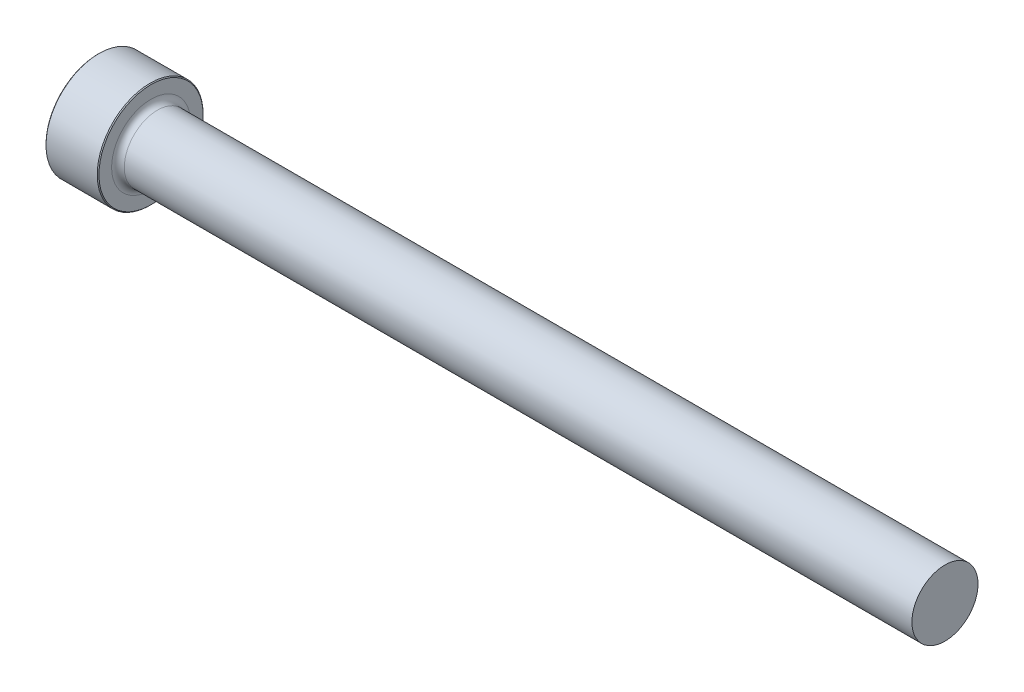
SolidWorks part; units mm, degrees
ref_plane "Front Plane" through (0, 0, 0) normal (0, 0, 1) x (1, 0, 0)
ref_plane "Top Plane" through (0, 0, 0) normal (0, 1, 0) x (1, 0, 0)
ref_plane "Right Plane" through (0, 0, 0) normal (1, 0, 0) x (0, 0, -1)
sketch "Sketch1" plane through (0, 0, 0) normal (0, 0, 1) x (1, 0, 0)
  line L0 (0, 0) -> (0, 6.35)
  line L1 (0, 6.35) -> (6.35, 6.35)
  line L2 (6.35, 6.35) -> (6.35, 4.7269)
  line L3 (7.112, 3.9649) -> (101.6, 3.9649)
  line L4 (101.6, 3.9649) -> (101.6, 0)
  line L5 (101.6, 0) -> (0, 0)
  line L6 (101.6, 0) -> (101.6, -3.9649) construction
  line L7 (101.6, -3.9649) -> (6.35, -3.9649) construction
  line L8 (0, 0) -> (0, -6.35) construction
  line L9 (0, -6.35) -> (6.35, -6.35) construction
  line L10 (6.35, -6.35) -> (6.35, -3.9649) construction
  arc A0 (6.35, 4.7269) -> (7.112, 3.9649) centre (7.112, 4.7269) ccw
  dimension "D4" = 0.762
  dimension "L" = 101.6
  dimension "D" = 7.9299
  dimension "H" = 12.7
  dimension "T" = 6.35
revolve "Revolve1" add sketch "Sketch1" angle 360 about L5
chamfer "Chamfer1" distance 0.1016 angle 45 2 edges at (0, 6.35, 0) (6.35, 6.35, 0)
